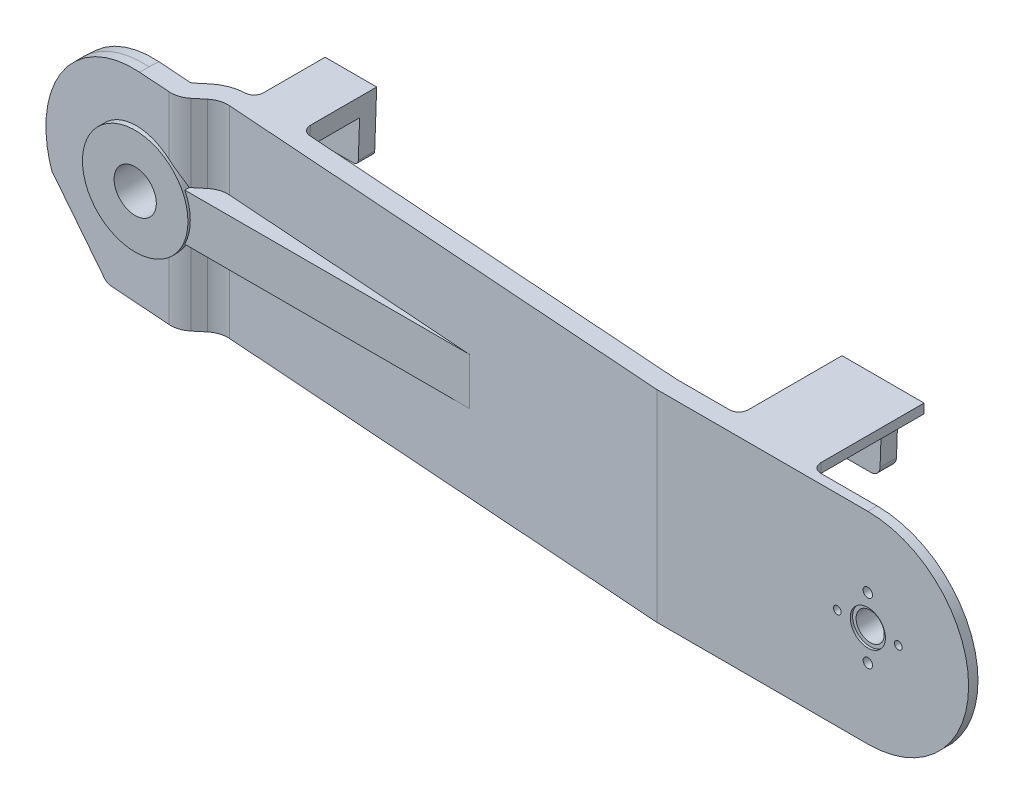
SolidWorks part; units mm, degrees
ref_plane "Plan de face" through (0, 0, 0) normal (0, 0, 1) x (1, 0, 0)
ref_plane "Plan de dessus" through (0, 0, 0) normal (0, 1, 0) x (1, 0, 0)
ref_plane "Plan de droite" through (0, 0, 0) normal (1, 0, 0) x (0, 0, -1)
ref_plane "Face-avt bras droit01_Rendre symétrique" through (0, 0, 112) normal (0, 0, -1) x (1, 0, 0)
ref_plane "Dessus-avt bras droit01_Rendre symétrique" through (0, 0, 112) normal (0, 1, 0) x (1, 0, 0)
ref_plane "Droite-avt bras droit01_Rendre symétrique" through (0, 0, 112) normal (1, 0, 0) x (0, 0, 1)
ref_plane "Plan1-avt bras droit01_Rendre symétrique" through (-65, 0, 112) normal (1, 0, 0) x (0, 0, 1)
ref_plane "Plan2-avt bras droit01_Rendre symétrique" through (0, 0, 107) normal (0, 0, -1) x (1, 0, 0)
mirrored part "avt bras droit01_Rendre symétrique"
other "<avt bras droit01>-<Enlèv. mat.-Extru.10>"
sketch "Esquisse1" plane through (-8.3003, 0, 118.6995) normal (0.0698, 0, -0.9976) x (-0.9976, 0, -0.0698)
  line L0 (374.2222, 0) -> (255.539, 0) construction
  line L1 (304.4642, -13.4937) -> (373.9552, -53.6144) construction
  line L2 (311.0924, 0) -> (380.1252, -39.8561) construction
  line L3 (345.6088, -19.9281) -> (348.779, -21.7584)
  line L4 (349.2614, -24.8331) -> (341.7072, -33.1734)
  line L5 (339.2249, -33.5628) -> (335.3077, -31.3012)
  line L6 (350.0723, -15) -> (325.9058, -41.6816) construction
  line L7 (335.3077, -31.3012) -> (345.6088, -19.9281)
  line L8 (322.9411, -38.9964) -> (346.5797, -12.8976) construction
  arc A0 (341.7072, -33.1734) -> (339.2249, -33.5628) centre (340.2249, -31.8308) cw
  arc A1 (349.2614, -24.8331) -> (348.779, -21.7584) centre (347.779, -23.4905) ccw
  point P16 (340.6233, -34.3702)
  point P19 (350.9244, -22.997)
  dimension "D4" = 2
  dimension "D1" = 30
  dimension "D2" = 15
  dimension "D3" = 10
extrude "Extrusion1" add sketch "Esquisse1" against normal blind 4
fillet "Congé1" radius 4 2 edges at (-342.9307, -31.3012, 97.3048) (-353.2067, -19.9281, 96.5862)
sketch "Esquisse3" plane through (0, 0, 108) normal (0, 0, -1) x (-1, 0, 0)
  line L0 (288.1927, 17) -> (248.346, 17) construction
  line L1 (283.5, 43) -> (261.5, 43)
  line L2 (285.9983, 43) -> (90, 43) construction
  line L3 (261.5, 43) -> (262.4079, 17)
  line L4 (262.4079, 17) -> (282.5921, 17)
  line L5 (261.5, -17.7423) -> (261.5, 76.5444) construction
  line L6 (283.5, -21.9852) -> (283.5, 85.973) construction
  line L7 (272.5, -68.5937) -> (272.5, 142.1371) construction
  line L8 (282.5921, 17) -> (283.5, 43)
  point P15 (282.5921, 17)
  dimension "D1" = 26
  dimension "D2" = 2
  dimension "D3" = 2
  dimension "D4" = 11
  dimension "D5" = 272.5
  dimension "D6" = 22
extrude "Extrusion2" add sketch "Esquisse3" along normal blind 52
sketch "Esquisse4" plane through (0, 43, 0) normal (0, 1, 0) x (-1, 0, 0)
  line L0 (261.5, 100.0076) -> (283.5, 98.4692)
  line L1 (283.5, 98.4692) -> (283.5, 108)
  line L2 (283.5, 108) -> (261.5, 108)
  line L3 (261.5, 108) -> (261.5, 100.0076)
extrude "Enlèv. mat.-Extru.1" cut sketch "Esquisse4" against normal blind 52
sketch "Esquisse5" plane through (0, 17, 0) normal (0, -1, 0) x (1, 0, 0)
  line L0 (-283.9673, 94.4267) -> (-258.9183, 96.1783)
  line L1 (-262.4079, 95.9343) -> (-282.5921, 94.5229) construction
  line L5 (-258.9183, 96.1783) -> (-258.9183, 63)
  line L8 (-258.9183, 63) -> (-285.7473, 63)
  line L10 (-285.7473, 63) -> (-283.9673, 94.4267)
  line L11 (-262.4079, 56) -> (-282.5921, 56) construction
  dimension "D1" = 7
extrude "Enlèv. mat.-Extru.2" cut sketch "Esquisse5" against normal blind 18
fillet "Congé2" radius 2 1 edges at (-262.4079, 17, 59.5)
fillet "Congé3" radius 2 1 edges at (-282.5921, 17, 59.5)
ref_plane "Plan1" through (0, 0, 116) normal (0, 0, -1) x (-1, 0, 0)
sketch "Esquisse6" plane through (0, 0, 56) normal (0, 0, -1) x (-1, 0, 0)
  line L0 (283.5, -43) -> (261.5, -43)
  line L1 (285.4403, -43) -> (87.4759, -43) construction
  line L2 (261.5, -43) -> (262.6548, -9.9302)
  line L3 (264.6536, -8) -> (280.3464, -8)
  line L4 (282.3452, -9.9302) -> (283.5, -43)
  line L5 (272.5, 3.5787) -> (272.5, -77.0567) construction
  line L6 (261.5, -43) -> (261.5, 11.6966) construction
  line L7 (283.5, -43) -> (283.5, 7.7341) construction
  arc A0 (262.6548, -9.9302) -> (264.6536, -8) centre (264.6536, -10) cw
  arc A1 (282.3452, -9.9302) -> (280.3464, -8) centre (280.3464, -10) ccw
  dimension "D3" = 2
  dimension "D1" = 2
  dimension "D2" = 2
  dimension "D4" = 272.5
  dimension "D5" = 35
  dimension "D6" = 11
  dimension "D7" = 11
extrude "Extrusion3" add sketch "Esquisse6" against normal up to body separate body
sketch "Esquisse7" plane through (0, -8, 0) normal (0, 1, 0) x (-1, 0, 0)
  line L0 (286.294, 94.264) -> (257.961, 96.2453)
  line L1 (280.3464, 94.6799) -> (264.6536, 95.7773) construction
  line L2 (257.961, 96.2453) -> (257.961, 63)
  line L3 (257.961, 63) -> (286.294, 63)
  line L4 (286.294, 63) -> (286.294, 94.264)
  line L5 (280.3464, 56) -> (264.6536, 56) construction
  dimension "D1" = 7
extrude "Enlèv. mat.-Extru.3" cut sketch "Esquisse7" against normal blind 28
fillet "Congé4" radius 4 8 edges at (-285.4403, -41, 90.3139) (-285.4403, 41, 90.3139) (-63, 41, 104) (-28, 41, 108) (-283.4302, 41, 90.4545) (-261.5698, 41, 91.9831) (-283.4302, -41, 90.4545) (-261.5698, -41, 91.9831)
sketch "Esquisse8" plane through (0, 0, 100) normal (0, 0, -1) x (-1, 0, 0)
  circle A0 centre (0, 0) radius 6
extrude "Enlèv. mat.-Extru.4" cut sketch "Esquisse8" against normal through all
sketch "Esquisse9" plane through (0, 0, 112) normal (0, 0, 1) x (1, 0, 0)
  circle A0 centre (0, 0) radius 7.5
extrude "Enlèv. mat.-Extru.5" cut sketch "Esquisse9" against normal blind 1
sketch "Esquisse12" plane through (0, 0, 112) normal (0, 0, 1) x (1, 0, 0)
  circle A0 centre (-317.5, 0) radius 12.5
  dimension "D1" = 317.5
extrude "Extrusion5" add sketch "Esquisse12" against normal blind 18
sketch "Esquisse13" plane through (0, -43, 0) normal (0, -1, 0) x (1, 0, 0)
  line L0 (-295, 107) -> (-340, 107) construction
  line L1 (-303.3102, 107) -> (-332.2221, 107)
  line L2 (-303.3102, 107) -> (-303.3102, 113.6532)
  line L3 (-303.3102, 113.6532) -> (-332.2221, 113.6532)
  line L4 (-332.2221, 107) -> (-332.2221, 113.6532)
extrude "Enlèv. mat.-Extru.7" cut sketch "Esquisse13" against normal blind 110
fillet "Congé5" radius 2 1 edges at (-305, 0, 101.962)
sketch "Esquisse14" plane through (0, 0, 94) normal (0, 0, -1) x (-1, 0, 0)
  circle A0 centre (317.5, 0) radius 9
extrude "Enlèv. mat.-Extru.8" cut sketch "Esquisse14" against normal through all
ref_plane "Plan2" through (0, 0, 106) normal (0, 0, 1) x (1, 0, 0)
sketch "Esquisse15" plane through (0, 0, 106) normal (0, 0, 1) x (1, 0, 0)
  line L0 (81.5471, 0) -> (-384.2722, 0) construction
  line L2 (-150, -10) -> (-300, -10)
  line L3 (-150, -10) -> (-150, 10)
  line L4 (-150, 10) -> (-300, 10)
  line L5 (-300, -10) -> (-300, 10)
  dimension "D1" = 150
  dimension "D2" = 300
  dimension "D3" = 20
  dimension "D4" = 10
extrude "Extrusion6" add sketch "Esquisse15" against normal up to body separate body
sketch "Esquisse16" plane through (0, 0, 56) normal (0, 0, -1) x (-1, 0, 0)
  line L1 (302.2711, 118.4303) -> (-40.8115, 118.4303)
  line L2 (302.2711, 118.4303) -> (302.2711, -160.7774)
  line L3 (302.2711, -160.7774) -> (-40.8115, -160.7774)
  line L4 (-40.8115, 118.4303) -> (-40.8115, -160.7774)
extrude "Enlèv. mat.-Extru.9" cut sketch "Esquisse16" against normal blind 4
ref_plane "Plan3" through (-282.6595, 18.9302, 63) normal (0.0349, -0.9994, 0) x (0.9994, 0.0349, 0)
sketch "Esquisse18" plane through (0, 0, 63) normal (0, 0, 1) x (1, 0, 0)
  line L0 (-261.7794, 35) -> (-262.3405, 18.9302) construction
  line L1 (-264.3393, 17) -> (-280.6607, 17) construction
  line L2 (-282.6595, 18.9302) -> (-283.2206, 35) construction
  line L3 (-283.2206, 35) -> (-261.7794, 35) construction
  line L4 (-261.7794, 35) -> (-262.3405, 18.9302)
  line L5 (-264.3393, 17) -> (-280.6607, 17)
  line L6 (-282.6595, 18.9302) -> (-283.2206, 35)
  line L7 (-283.2206, 35) -> (-261.7794, 35)
  arc A0 (-264.3393, 17) -> (-262.3405, 18.9302) centre (-264.3393, 19) ccw construction
  arc A1 (-282.6595, 18.9302) -> (-280.6607, 17) centre (-280.6607, 19) ccw construction
  arc A2 (-264.3393, 17) -> (-262.3405, 18.9302) centre (-264.3393, 19) ccw
  arc A3 (-282.6595, 18.9302) -> (-280.6607, 17) centre (-280.6607, 19) ccw
extrude "Extrusion7" add sketch "Esquisse18" along normal blind 4
sketch "Esquisse19" plane through (0, 0, 63) normal (0, 0, 1) x (1, 0, 0)
  line L0 (-261.7444, -36) -> (-262.6548, -9.9302) construction
  line L1 (-261.7444, -36) -> (-283.2556, -36) construction
  line L2 (-282.3452, -9.9302) -> (-283.2556, -36) construction
  line L3 (-264.6536, -8) -> (-280.3464, -8) construction
  line L4 (-261.7444, -36) -> (-262.6548, -9.9302)
  line L5 (-261.7444, -36) -> (-283.2556, -36)
  line L6 (-282.3452, -9.9302) -> (-283.2556, -36)
  line L7 (-264.6536, -8) -> (-280.3464, -8)
  arc A0 (-262.6548, -9.9302) -> (-264.6536, -8) centre (-264.6536, -10) ccw construction
  arc A1 (-280.3464, -8) -> (-282.3452, -9.9302) centre (-280.3464, -10) ccw construction
  arc A2 (-262.6548, -9.9302) -> (-264.6536, -8) centre (-264.6536, -10) ccw
  arc A3 (-280.3464, -8) -> (-282.3452, -9.9302) centre (-280.3464, -10) ccw
extrude "Extrusion8" add sketch "Esquisse19" along normal blind 4
sketch "Esquisse20" plane through (0, 0, 63) normal (0, 0, 1) x (1, 0, 0)
  line L0 (-58.2269, 16.8604) -> (-58.7929, 33.0686) construction
  line L1 (-43.7707, 13) -> (-54.2293, 13) construction
  line L2 (-39.231, 32.3855) -> (-39.7731, 16.8604) construction
  line L3 (-58.7929, 33.0686) -> (-39.231, 32.3855) construction
  line L4 (-58.2269, 16.8604) -> (-58.7929, 33.0686)
  line L5 (-43.7707, 13) -> (-54.2293, 13)
  line L6 (-39.231, 32.3855) -> (-39.7731, 16.8604)
  line L7 (-58.7929, 33.0686) -> (-39.231, 32.3855)
  arc A0 (-58.2269, 16.8604) -> (-54.2293, 13) centre (-54.2293, 17) ccw construction
  arc A1 (-43.7707, 13) -> (-39.7731, 16.8604) centre (-43.7707, 17) ccw construction
  arc A2 (-58.2269, 16.8604) -> (-54.2293, 13) centre (-54.2293, 17) ccw
  arc A3 (-43.7707, 13) -> (-39.7731, 16.8604) centre (-43.7707, 17) ccw
extrude "Extrusion9" add sketch "Esquisse20" along normal blind 4
sketch "Esquisse21" plane through (0, 0, 100) normal (0, 0, -1) x (-1, 0, 0)
  circle A0 centre (0, -13) radius 2
  circle A1 centre (0, 13) radius 2
  dimension "D1" = 4
  dimension "D2" = 13
  dimension "D3" = 13
extrude "Enlèv. mat.-Extru.10" cut sketch "Esquisse21" against normal up to next
hole_wizard "Trou taraudé M41" positions "Esquisse3D1" profile "Esquisse22" tap size "M4" standard "ISO"
sketch3d "Esquisse3D1"
  line L1 (13, 0, 100) -> (-13, 0, 100) construction
  circle A0 centre (0, 0, 100) radius 6 construction
  point P0 (13, 0, 100)
  point P2 (-13, 0, 100)
  point P10 (0, 0, 94)
  dimension "D1" = 13
  dimension "D2" = 13
sketch "Esquisse22" plane through (13, 0, 100) normal (1, 0, 0) x (0, 1, 0)
  line L0 (0, 0) -> (0, 12.0003)
  line L1 (0, 12.0003) -> (1.65, 12.0003)
  line L2 (1.65, 12.0003) -> (1.65, 0)
  line L5 (1.65, 0) -> (0, 0)
  line L11 (0, -6.35) -> (0, 107.95) construction
  dimension "Diamètre du trou pour taraudage jusqu'au prochain" = 3.3
  dimension "Profondeur du trou pour taraudage jusqu'au prochain" = 12.0003
